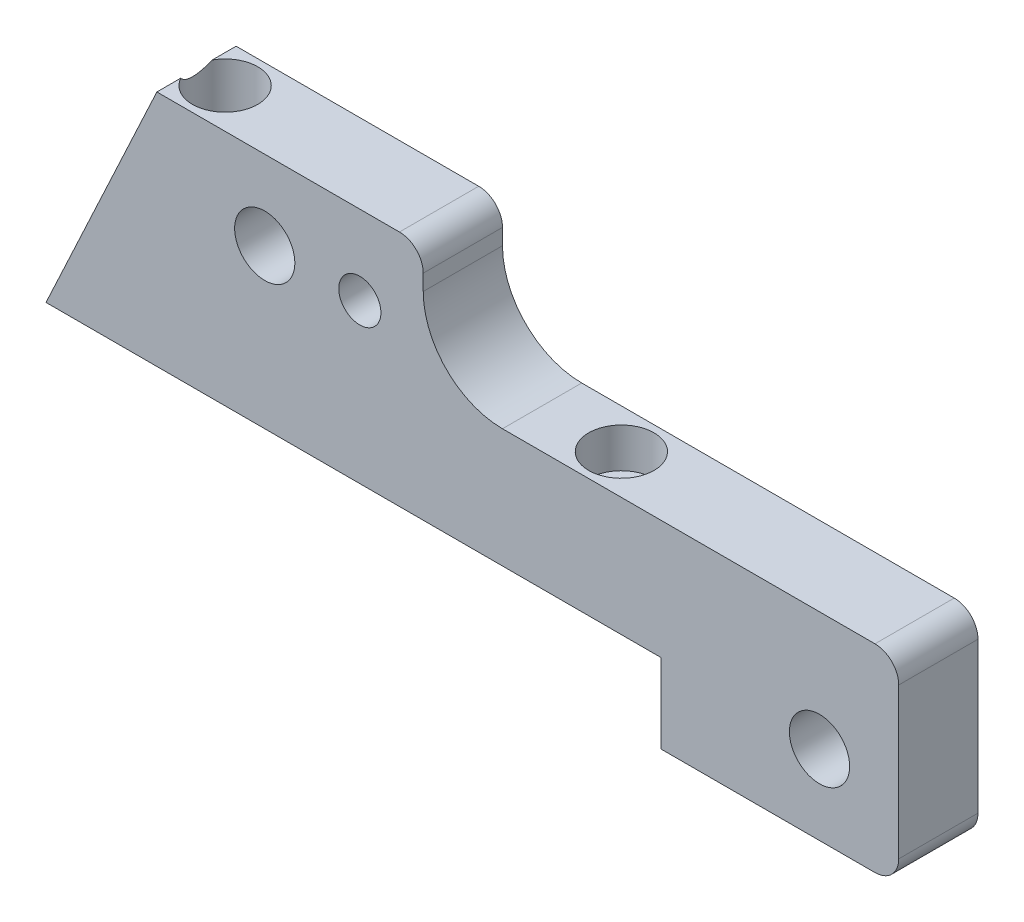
SolidWorks part; units mm, degrees
ref_plane "Front Plane" through (0, 0, 0) normal (0, 0, 1) x (1, 0, 0)
ref_plane "Top Plane" through (0, 0, 0) normal (0, 1, 0) x (1, 0, 0)
ref_plane "Right Plane" through (0, 0, 0) normal (1, 0, 0) x (0, 0, -1)
sketch "Sketch1" plane through (0, 0, 0) normal (0, 0, 1) x (1, 0, 0)
  line L0 (-1000, 0) -> (49000, 0) construction
  line L1 (0, -1000) -> (0, 49000) construction
  line L2 (0, 0) -> (-98.552, 0)
  line L3 (-98.552, 0) -> (-80.7857, 38.1)
  line L4 (-80.7857, 38.1) -> (-41.91, 38.1)
  line L5 (-38.1, 34.29) -> (-38.1, 31.75)
  line L6 (-25.4, 19.05) -> (34.29, 19.05)
  line L7 (38.1, 15.24) -> (38.1, -8.89)
  line L8 (34.29, -12.7) -> (0, -12.7)
  line L9 (0, -12.7) -> (0, 0)
  circle A0 centre (-63.5, 25.4) radius 4.826
  circle A1 centre (25.4, 0) radius 4.826
  arc A2 (38.1, -8.89) -> (34.29, -12.7) centre (34.29, -8.89) cw
  arc A3 (34.29, 19.05) -> (38.1, 15.24) centre (34.29, 15.24) cw
  arc A4 (-41.91, 38.1) -> (-38.1, 34.29) centre (-41.91, 34.29) cw
  arc A5 (-38.1, 31.75) -> (-25.4, 19.05) centre (-25.4, 31.75) ccw
  dimension "D1" = 3.81
  dimension "D2" = 12.7
  dimension "D14" = 9.652
  dimension "D3" = 65
  dimension "D4" = 12.7
  dimension "D5" = 31.75
  dimension "D6" = 38.1
  dimension "D7" = 50.8
  dimension "D8" = 12.7
  dimension "D9" = 38.1
  dimension "D10" = 12.7
  dimension "D11" = 76.2
  dimension "D12" = 136.652
  dimension "D13" = 101.6
extrude "Boss-Extrude1" add sketch "Sketch1" along normal mid plane 12.7
sketch "Sketch2" plane through (0, 0, 6.35) normal (0, 0, 1) x (1, 0, 0)
  line L0 (38.1, -8.89) -> (38.1, 15.24) construction
  point P0 (-48.26, 25.4)
  point P6 (-63.5, 25.4)
  dimension "D1" = 86.36
sketch "Sketch5" plane through (0, 38.1, 0) normal (0, 1, 0) x (1, 0, 0)
  line L0 (38.1, -6.35) -> (38.1, 6.35) construction
  point P0 (-76.2, 0)
  dimension "D1" = 114.3
hole_wizard "CBORE for 1/4 Pan Head Machine Screw2" positions "Sketch6" profile "Sketch7" counterbore size "1/4" standard "ANSI Inch"
sketch "Sketch6" plane through (0, 38.1, 0) normal (0, 1, 0) x (1, 0, 0)
  point P0 (-76.2, 0)
sketch "Sketch7" plane through (-76.2, 38.1, 0) normal (1, 0, 0) x (0, 0, 1)
  line L0 (0, 0) -> (0, 50.8)
  line L1 (0, 50.8) -> (3.3782, 50.8)
  line L3 (3.3782, 50.8) -> (3.3782, 19.05)
  line L4 (3.3782, 19.05) -> (5.2324, 19.05)
  line L5 (5.2324, 19.05) -> (5.2324, 0)
  line L7 (5.2324, 0) -> (0, 0)
  line L11 (0, -6.35) -> (0, 107.95) construction
  dimension "Thru Hole Dia." = 6.7564
  dimension "Thru Hole Depth" = 50.8
  dimension "C'Bore Dia." = 10.4648
  dimension "C'Bore Depth" = 19.05
sketch "Sketch8" plane through (0, 19.05, 0) normal (0, 1, 0) x (1, 0, 0)
  line L0 (38.1, -6.35) -> (38.1, 6.35) construction
  point P0 (-12.7, 0)
  point P3 (38.1, 0)
  dimension "D1" = 50.8
hole_wizard "CBORE for 1/4 Pan Head Machine Screw3" positions "Sketch9" profile "Sketch10" counterbore size "1/4" standard "ANSI Inch"
sketch "Sketch9" plane through (0, 19.05, 0) normal (0, 1, 0) x (1, 0, 0)
  point P0 (-12.7, 0)
sketch "Sketch10" plane through (-12.7, 19.05, 0) normal (1, 0, 0) x (0, 0, 1)
  line L0 (0, 0) -> (0, 31.75)
  line L1 (0, 31.75) -> (3.3782, 31.75)
  line L3 (3.3782, 31.75) -> (3.3782, 6.35)
  line L4 (3.3782, 6.35) -> (5.2324, 6.35)
  line L5 (5.2324, 6.35) -> (5.2324, 0)
  line L7 (5.2324, 0) -> (0, 0)
  line L11 (0, -6.35) -> (0, 107.95) construction
  dimension "Thru Hole Dia." = 6.7564
  dimension "Thru Hole Depth" = 31.75
  dimension "C'Bore Dia." = 10.4648
  dimension "C'Bore Depth" = 6.35
sketch "Sketch11" plane through (0, 0, -6.35) normal (0, 0, -1) x (-1, 0, 0)
  point P0 (48.26, 25.4)
hole_wizard "CBORE for 1/4 Pan Head Machine Screw4" positions "Sketch12" profile "Sketch13" counterbore size "1/4" standard "ANSI Inch"
sketch "Sketch12" plane through (0, 0, -6.35) normal (0, 0, -1) x (-1, 0, 0)
  point P0 (48.26, 25.4)
sketch "Sketch13" plane through (-48.26, 25.4, -6.35) normal (1, 0, 0) x (0, 1, 0)
  line L0 (0, 0) -> (0, 19.5558)
  line L1 (0, 19.5558) -> (3.3782, 17.526)
  line L2 (3.3782, 17.526) -> (3.3782, 6.35)
  line L3 (3.3782, 6.35) -> (6.7462, 6.35)
  line L4 (6.7462, 6.35) -> (6.7462, 0)
  line L5 (6.7462, 0) -> (0, 0)
  line L10 (0, 19.5558) -> (-3.3782, 17.526) construction
  line L11 (0, -6.35) -> (0, 107.95) construction
  dimension "Hole Dia." = 6.7564
  dimension "Hole Depth" = 17.526
  dimension "C'Bore Dia." = 13.4925
  dimension "C'Bore Depth" = 6.35
  dimension "Drill Angle" = 118
